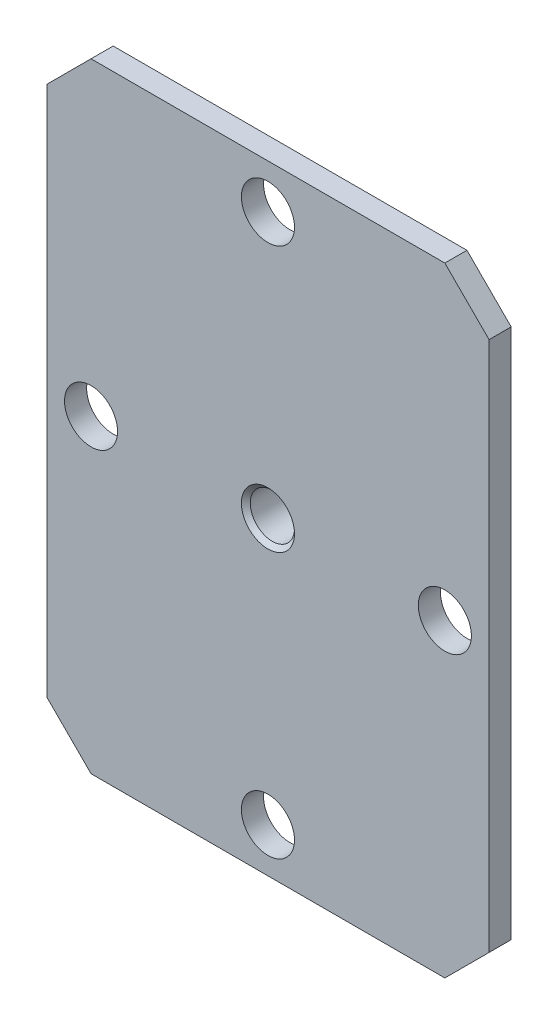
SolidWorks part; units mm, degrees
ref_plane "Спереди" through (0, 0, 0) normal (0, 0, 1) x (1, 0, 0)
ref_plane "Сверху" through (0, 0, 0) normal (0, 1, 0) x (1, 0, 0)
ref_plane "Справа" through (0, 0, 0) normal (1, 0, 0) x (0, 0, -1)
sketch "Sketch1" plane through (0, 0, 0) normal (0, 0, 1) x (1, 0, 0)
  line L4 (-50, -70) -> (-50, 70)
  line L5 (-50, 70) -> (50, 70)
  line L6 (50, -70) -> (50, 70)
  line L7 (-50, -70) -> (50, -70)
  line L8 (0, 104.1724) -> (0, -99.0659) construction
  line L9 (106.7257, 0) -> (-111.8321, 0) construction
  dimension "D1" = 100
  dimension "D2" = 140
extrude "Extrude1" add sketch "Sketch1" along normal blind 5
sketch "Sketch2" plane through (0, 0, 5) normal (0, 0, 1) x (1, 0, 0)
  line L0 (0, 79.029) -> (0, -82.6512) construction
  line L1 (89.5662, 0) -> (-89.2369, 0) construction
  circle A0 centre (0, 60) radius 6
  circle A1 centre (40, 0) radius 6
  circle A2 centre (0, -60) radius 6
  circle A3 centre (-40, 0) radius 6
  point P7 (0, -1.8111)
  dimension "D1" = 60
  dimension "D2" = 12
  dimension "D3" = 40
  dimension "D4" = 40
  dimension "D5" = 60
extrude "Cut-Extrude1" cut sketch "Sketch2" against normal up to next
chamfer "Chamfer1" distance 10 angle 45 4 edges at (-50, 70, 2.5) (50, 70, 2.5) (50, -70, 2.5) (-50, -70, 2.5)
sketch "Sketch3" plane through (0, 0, 5) normal (0, 0, 1) x (1, 0, 0)
  line L0 (0, 60) -> (0, -60) construction
  line L1 (40, 0) -> (-40, 0) construction
  line L2 (-10, -10) -> (-10, 10)
  line L3 (-10, 10) -> (10, 10)
  line L4 (10, -10) -> (10, 10)
  line L5 (-10, -10) -> (10, -10)
  dimension "D1" = 20
extrude "Extrude2" add sketch "Sketch3" against normal blind 7 from surface at -5
sketch "Sketch4" plane through (0, 0, 5) normal (0, 0, 1) x (1, 0, 0)
  circle A0 centre (0, 0) radius 5
  dimension "D1" = 10
extrude "Cut-Extrude2" cut sketch "Sketch4" against normal up to next
chamfer "Chamfer2" distance 1 angle 45 1 edges at (5, 0, 5)
